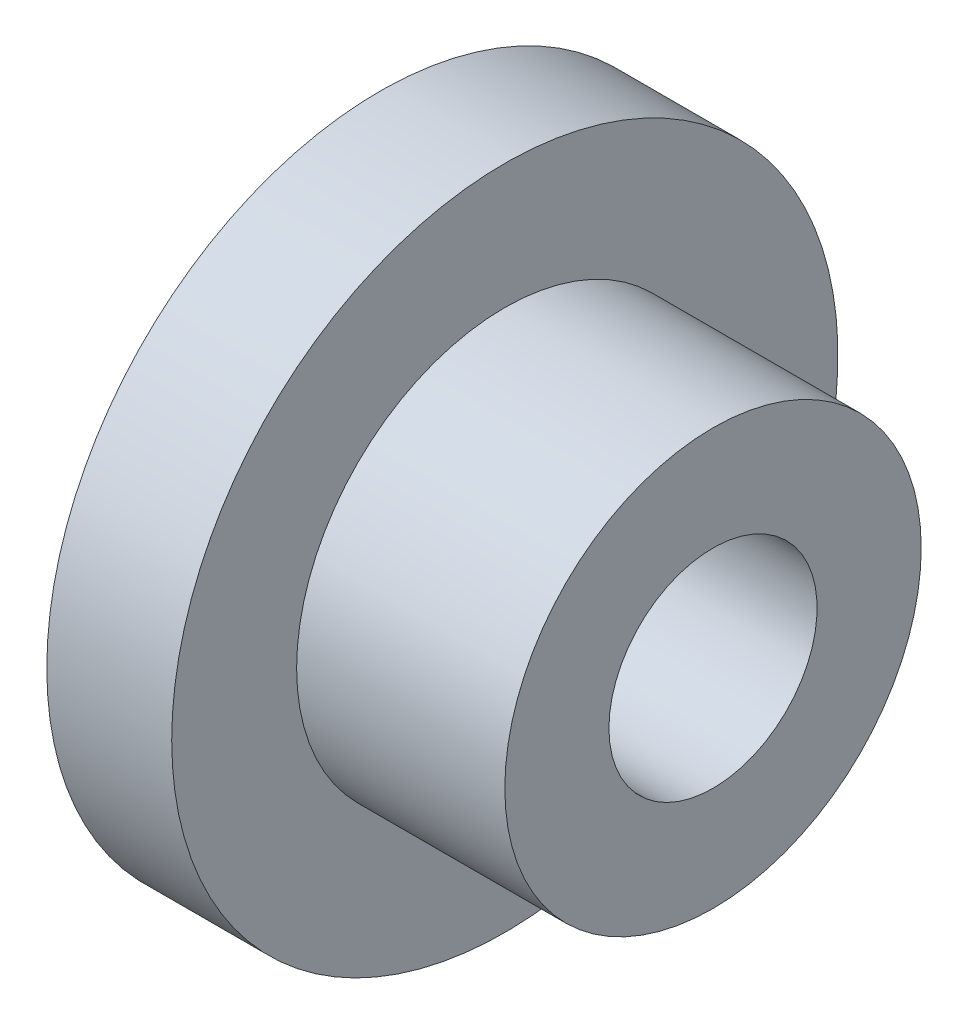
SolidWorks part; units mm, degrees
ref_plane "Front" through (0, 0, 0) normal (0, 0, 1) x (1, 0, 0)
ref_plane "Top" through (0, 0, 0) normal (0, 1, 0) x (1, 0, 0)
ref_plane "Right" through (0, 0, 0) normal (1, 0, 0) x (0, 0, -1)
sketch "Sketch1" plane through (0, 0, 0) normal (0, 0, 1) x (1, 0, 0)
  line L0 (0, 0) -> (8, 0)
  line L1 (8, 2.5) -> (8, 5)
  line L2 (8, 5) -> (3, 5)
  line L3 (3, 5) -> (3, 8)
  line L4 (3, 8) -> (0, 8)
  line L5 (0, 8) -> (0, 2.5)
  line L6 (0, 2.5) -> (8, 2.5)
revolve "Revolve1" add sketch "Sketch1" angle 360 about L0
